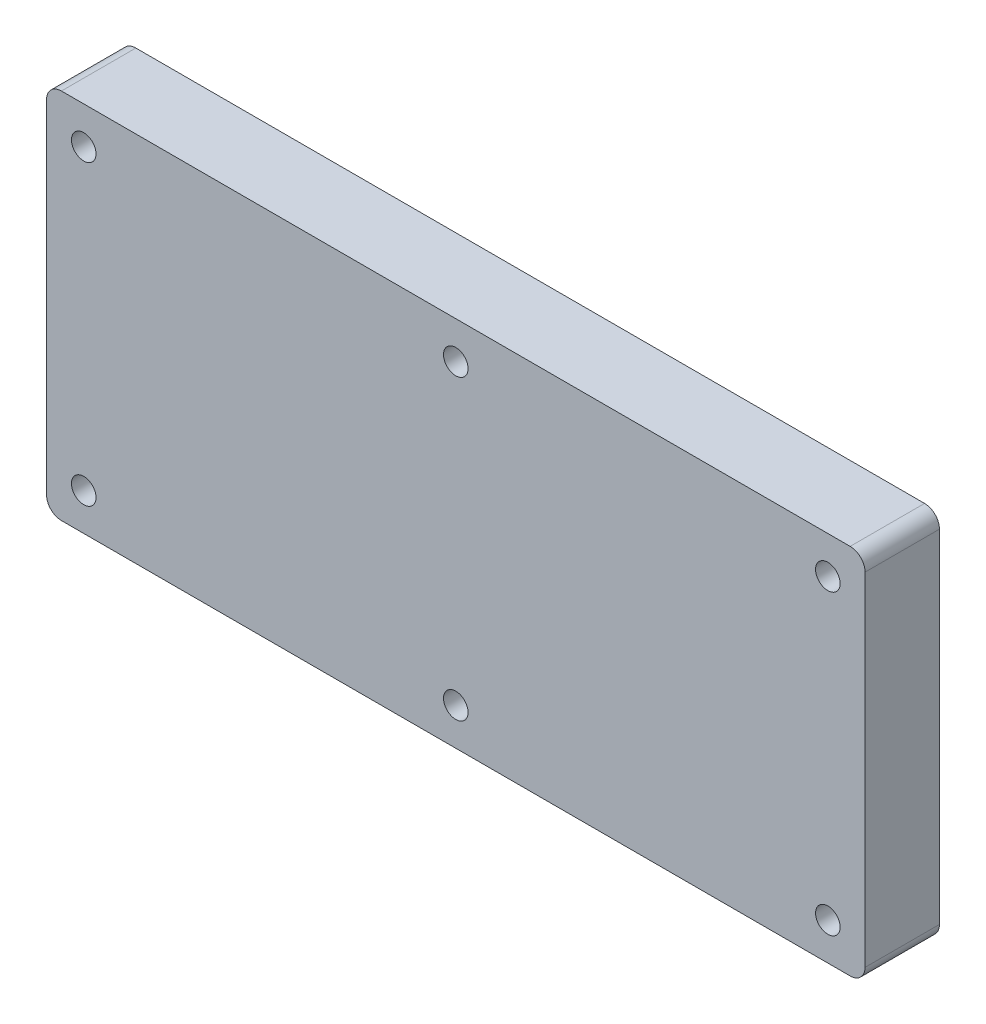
SolidWorks part; units mm, degrees
ref_plane "前视基准面" through (0, 0, 0) normal (0, 0, 1) x (1, 0, 0)
ref_plane "上视基准面" through (0, 0, 0) normal (0, 1, 0) x (1, 0, 0)
ref_plane "右视基准面" through (0, 0, 0) normal (1, 0, 0) x (0, 0, -1)
other "Configuration Table"
sketch "草图1" plane through (0, 0, 0) normal (0, 0, 1) x (1, 0, 0)
  line L1 (-55, 25) -> (55, 25)
  line L2 (-55, 25) -> (-55, -25)
  line L3 (-55, -25) -> (55, -25)
  line L4 (55, 25) -> (55, -25)
  line L5 (-55, 25) -> (55, -25) construction
  line L6 (-55, -25) -> (55, 25) construction
  point P0 (0, 0)
  dimension "D1" = 110
  dimension "D2" = 50
extrude "凸台-拉伸1" add sketch "草图1" along normal blind 10
hole_wizard "M4 螺纹孔1" positions "草图2" profile "草图3" tap size "M4" standard "GB"
sketch "草图2" plane through (0, 0, 10) normal (0, 0, 1) x (1, 0, 0)
  line L0 (-55, 25) -> (-55, -25) construction
  line L1 (55, 25) -> (-55, 25) construction
  line L2 (55, -25) -> (55, 25) construction
  line L3 (-55, -25) -> (55, -25) construction
  point P0 (-50, 20)
  point P2 (0, 20)
  point P4 (50, 20)
  point P6 (-50, -20)
  point P8 (0, -20)
  point P10 (50, -20)
  dimension "D1" = 5
  dimension "D2" = 5
  dimension "D3" = 5
  dimension "D4" = 5
  dimension "D5" = 5
  dimension "D6" = 50
  dimension "D7" = 5
  dimension "D8" = 5
  dimension "D9" = 5
  dimension "D10" = 5
  dimension "D11" = 5
  dimension "D12" = 50
sketch "草图3" plane through (-50, 20, 10) normal (1, 0, 0) x (0, -1, 0)
  line L0 (0, 0) -> (0, 10)
  line L1 (0, 10) -> (1.65, 10)
  line L2 (1.65, 10) -> (1.65, 0)
  line L5 (1.65, 0) -> (0, 0)
  line L11 (0, -6.35) -> (0, 107.95) construction
  dimension "通孔螺纹孔钻头直径" = 3.3
  dimension "通孔螺纹孔钻头深度" = 10
fillet "圆角1" radius 2 4 edges at (55, 25, 5) (55, -25, 5) (-55, -25, 5) (-55, 25, 5)
